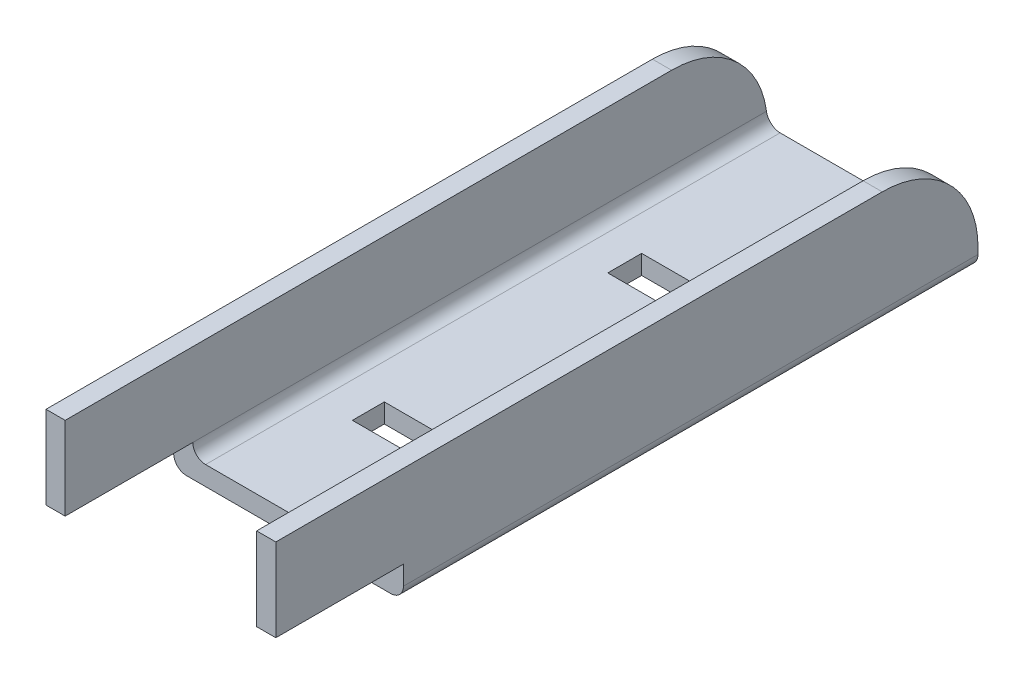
SolidWorks part; units mm, degrees
ref_plane "Plan de face" through (0, 0, 0) normal (0, 0, 1) x (1, 0, 0)
ref_plane "Plan de dessus" through (0, 0, 0) normal (0, 1, 0) x (1, 0, 0)
ref_plane "Plan de droite" through (0, 0, 0) normal (1, 0, 0) x (0, 0, -1)
sketch "Esquisse1" plane through (0, 0, 0) normal (0, 0, 1) x (1, 0, 0)
  line L0 (0, 15) -> (0, 0)
  line L1 (0, 0) -> (30, 0)
  line L2 (30, 0) -> (30, 15)
extrude "Extru.-Mince1" add sketch "Esquisse1" against normal blind 110 thin
sketch "Esquisse3" plane through (33, 0, 0) normal (1, 0, 0) x (0, 0, -1)
  line L1 (0, -3) -> (20, -3)
  line L2 (0, -3) -> (0, 2)
  line L3 (0, 2) -> (20, 2)
  line L4 (20, -3) -> (20, 2)
extrude "Extrusion1" cut sketch "Esquisse3" against normal blind 110
fillet "Congé4" radius 2 1 edges at (-3, -3, -65)
fillet "Congé5" radius 2 1 edges at (33, -3, -65)
fillet "Congé6" radius 2 1 edges at (0, 0, -65)
fillet "Congé7" radius 2 1 edges at (30, 0, -65)
fillet "Congé8" radius 15 1 edges at (-1.5, 15, -110)
fillet "Congé9" radius 15 1 edges at (31.5, 15, -110)
sketch "Esquisse4" plane through (0, -3, 0) normal (0, -1, 0) x (1, 0, 0)
  line L1 (7.5, -82.8066) -> (22.5, -82.8066)
  line L2 (7.5, -82.8066) -> (7.5, -77.5)
  line L3 (7.5, -77.5) -> (22.5, -77.5)
  line L4 (22.5, -82.8066) -> (22.5, -77.5)
  line L5 (7.5, -37.5) -> (22.5, -37.5)
  line L6 (7.5, -37.5) -> (7.5, -42.5)
  line L7 (7.5, -42.5) -> (22.5, -42.5)
  line L8 (22.5, -37.5) -> (22.5, -42.5)
extrude "Extrusion2" cut sketch "Esquisse4" against normal blind 110
